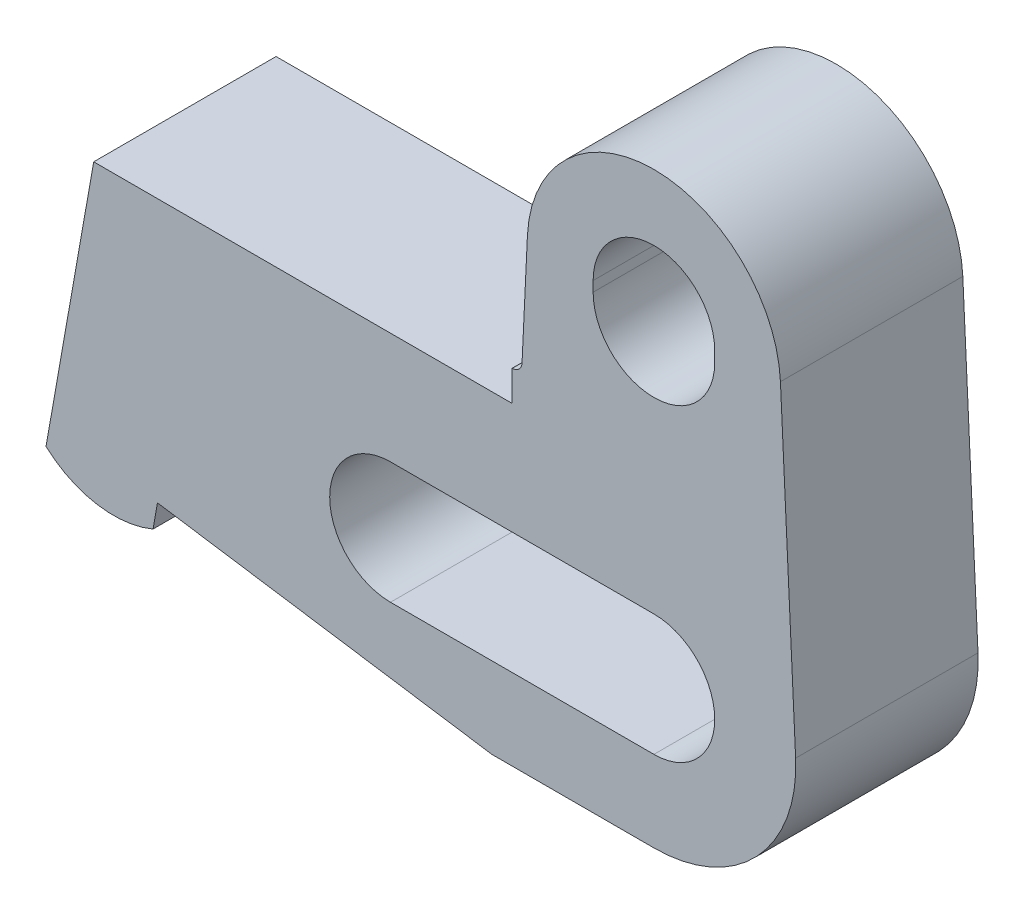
SolidWorks part; units mm, degrees
ref_plane "Plan de face" through (0, 0, 0) normal (0, 0, 1) x (1, 0, 0)
ref_plane "Plan de dessus" through (0, 0, 0) normal (0, 1, 0) x (1, 0, 0)
ref_plane "Plan de droite" through (0, 0, 0) normal (1, 0, 0) x (0, 0, -1)
sketch "Esquisse1" plane through (0, 0, 0) normal (0, 0, 1) x (1, 0, 0)
  line L0 (0, 0) -> (56.8729, 0) construction
  line L1 (-26, 6) -> (0, 6)
  line L2 (12.4858, 32.0952) -> (13.9841, 0.6667)
  line L3 (-26, -6) -> (0, -6)
  line L4 (0, -14) -> (-16, -14)
  line L5 (6, 31.5) -> (6, 30.5)
  line L6 (-6, 31.5) -> (-6, 30.5)
  line L7 (0, 30.5) -> (0, 18.4647) construction
  line L8 (-13.0171, 20.9504) -> (-12.4858, 32.0952)
  line L9 (-55.2928, 17) -> (-14, 17)
  line L10 (-14, 17) -> (-14, 20)
  line L11 (-13.9535, 20) -> (-14, 20)
  line L12 (-55.2928, 17) -> (-60, -9.6961)
  line L13 (-49, -9) -> (-49.4341, -11.462)
  line L16 (-16, -14) -> (-49, -9)
  arc A0 (0, -6) -> (0, 6) centre (0, 0) ccw
  arc A1 (-26, 6) -> (-26, -6) centre (-26, 0) ccw
  arc A2 (13.9841, 0.6667) -> (0, -14) centre (0, 0) cw
  arc A3 (12.4858, 32.0952) -> (-12.4858, 32.0952) centre (0, 31.5) ccw
  arc A4 (6, 31.5) -> (-6, 31.5) centre (0, 31.5) ccw
  arc A5 (-6, 30.5) -> (6, 30.5) centre (0, 30.5) ccw
  arc A6 (-13.0171, 20.9504) -> (-13.9535, 20) centre (-14.016, 20.998) cw
  arc A7 (-60, -9.6961) -> (-49.4341, -11.462) centre (-53.325, -2.25) ccw
  point P26 (-13, 20)
  dimension "D3" = 2.729
  dimension "D6" = 12.5
  dimension "D8" = 6
  dimension "D12" = 1
  dimension "D18" = 10
  dimension "D19" = 12
  dimension "D20" = 2.25
  dimension "D21" = 14
  dimension "D1" = 12
  dimension "D2" = 26
  dimension "D4" = 26
  dimension "D5" = 16
  dimension "D7" = 31.5
  dimension "D9" = 1
  dimension "D10" = 11
  dimension "D11" = 1
  dimension "D13" = 3
  dimension "D14" = 100
  dimension "D15" = 2.5
  dimension "D16" = 49
  dimension "D17" = 60
  dimension "D22" = 13
extrude "Extrusion1" add sketch "Esquisse1" along normal mid plane 18
